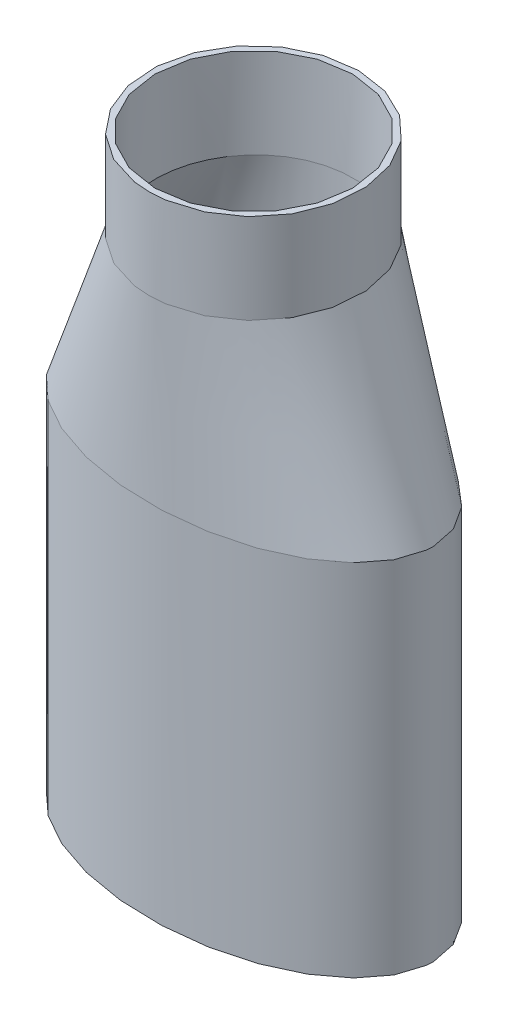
SolidWorks part; units mm, degrees
ref_plane "Plane1" through (0, 0, 0) normal (0, 0, 1) x (1, 0, 0)
ref_plane "Plane2" through (0, 0, 0) normal (0, 1, 0) x (1, 0, 0)
ref_plane "Plane3" through (0, 0, 0) normal (1, 0, 0) x (0, 0, -1)
ref_plane "Plane4" through (0, 60, 0) normal (0, 1, 0) x (-1, 0, 0)
ref_plane "Plane5" through (0, 90, 0) normal (0, 1, 0) x (-1, 0, 0)
sketch "Sketch5" plane through (0, 0, 0) normal (0, 1, 0) x (1, 0, 0)
  ellipse E0 centre (0, 0) end of major axis (30, 0) minor radius 17.5
  dimension "D1" = 60
  dimension "D2" = 35
extrude "Base-Extrude" add sketch "Sketch5" along normal up to surface (60 mm away)
sketch "Sketch6" plane through (0, 60, 0) normal (0, 1, 0) x (-1, 0, 0)
  ellipse E1 centre (0, 0) end of major axis (-30, 0) minor radius 17.5
  ellipse E2 centre (0, 0) end of major axis (-30, 0) minor radius 17.5
  dimension "D1" = 0
sketch "Sketch7" plane through (0, 90, 0) normal (0, 1, 0) x (-1, 0, 0)
  circle A0 centre (0, 0) radius 17.5
  ellipse E0 centre (0, 0) end of major axis (-30, 0) minor radius 17.5 construction
loft "Boss-Loft1" add profiles "Sketch6", "Sketch7"
sketch "Sketch8" plane through (0, 90, 0) normal (0, 1, 0) x (-1, 0, 0)
  circle A1 centre (0, 0) radius 17.5
  circle A2 centre (0, 0) radius 17.5
  dimension "D1" = 0
extrude "Boss-Extrude1" add sketch "Sketch8" along normal blind 15
shell "Shell1" thickness 1
